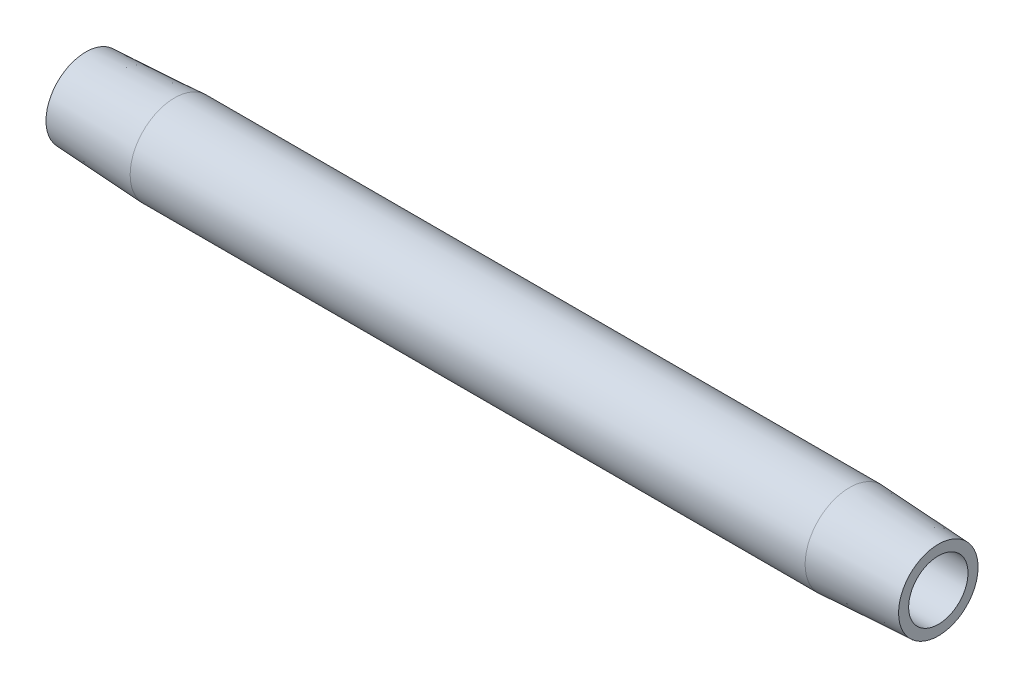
SolidWorks part; units mm, degrees
ref_plane "Front Plane" through (0, 0, 0) normal (0, 0, 1) x (1, 0, 0)
ref_plane "Top Plane" through (0, 0, 0) normal (0, 1, 0) x (1, 0, 0)
ref_plane "Right Plane" through (0, 0, 0) normal (1, 0, 0) x (0, 0, -1)
sketch "Sketch2" plane through (0, 0, 0) normal (0, 0, 1) x (1, 0, 0)
  line L0 (0.4761, 0) -> (50000.4761, 0) construction
  line L1 (0, -11.3625) -> (0, 49988.6375) construction
  line L7 (7.9375, 3.9687) -> (0, 3.5528)
  line L8 (68.2625, 3.9688) -> (7.9375, 3.9687)
  line L9 (76.2, 3.5528) -> (68.2625, 3.9688)
  line L10 (76.2, 2.6543) -> (76.2, 3.5528)
  line L11 (76.2, 2.6543) -> (0, 2.6543)
  line L12 (0, 3.5528) -> (0, 2.6543)
  dimension "D1" = 5.3086
  dimension "D2" = 7.9375
  dimension "D3" = 3
  dimension "D4" = 3
  dimension "D5" = 7.9375
  dimension "D6" = 7.9375
  dimension "D7" = 76.2
revolve "Revolve1" add sketch "Sketch2" angle 360 about L0
